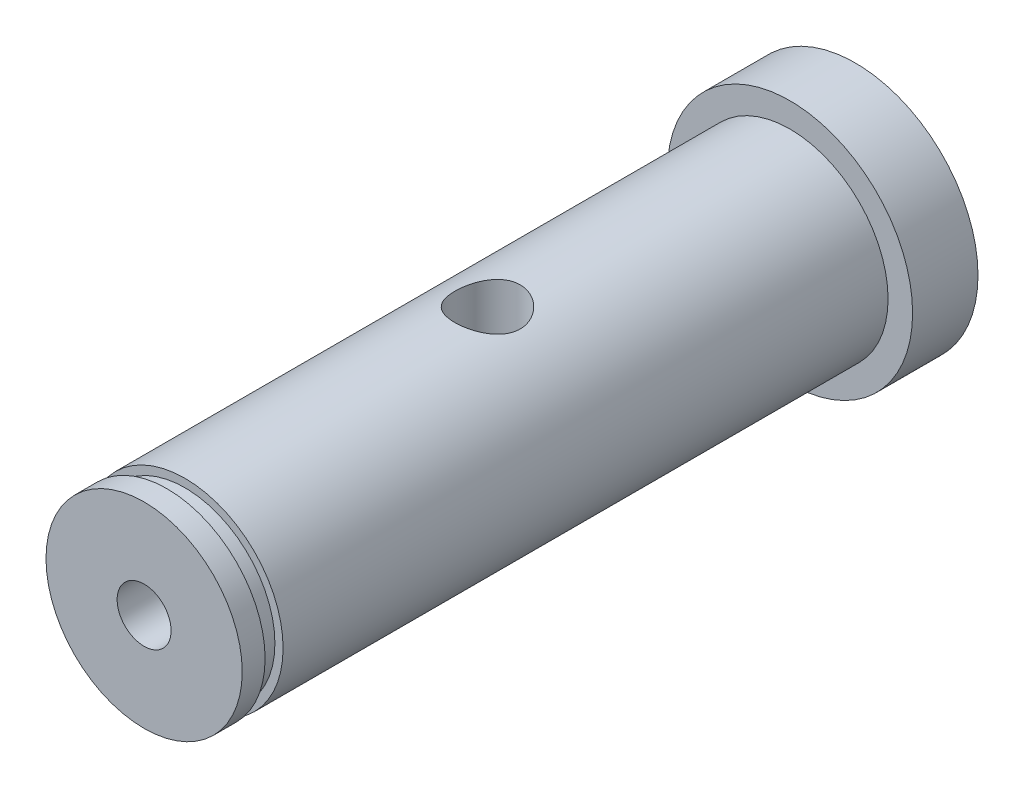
SolidWorks part; units mm, degrees
ref_plane "前视基准面" through (0, 0, 0) normal (0, 0, 1) x (1, 0, 0)
ref_plane "上视基准面" through (0, 0, 0) normal (0, 1, 0) x (1, 0, 0)
ref_plane "右视基准面" through (0, 0, 0) normal (1, 0, 0) x (0, 0, -1)
sketch "草图1" plane through (0, 0, 0) normal (0, 0, 1) x (1, 0, 0)
  circle A0 centre (0, 0) radius 6
  dimension "D1" = 12
extrude "凸台-拉伸1" add sketch "草图1" along normal mid plane 42
ref_plane "基准面1" through (0, 0, 18.5) normal (0, 0, 1) x (1, 0, 0)
sketch "草图2" plane through (0, 0, 18.5) normal (0, 0, 1) x (1, 0, 0)
  circle A0 centre (0, 0) radius 5.5
  circle A1 centre (0, 0) radius 7.2499
  dimension "D1" = 11
extrude "切除-拉伸1" cut sketch "草图2" along normal blind 1.1
hole_wizard "M4 螺纹孔1" positions "3D草图1" profile "草图4" tap size "M4" standard "GB"
sketch3d "3D草图1"
  line L0 (0, 0, 21) -> (0, 0, 19.6) construction
  point P0 (0, 0, 21)
sketch "草图4" plane through (0, 0, 21) normal (1, 0, 0) x (0, -1, 0)
  line L0 (0, 0) -> (0, 10.0914)
  line L1 (0, 10.0914) -> (1.65, 9.1)
  line L2 (1.65, 9.1) -> (1.65, 0)
  line L5 (1.65, 0) -> (0, 0)
  line L10 (0, 10.0914) -> (-1.65, 9.1) construction
  line L11 (0, -6.35) -> (0, 107.95) construction
  dimension "螺纹孔钻头直径" = 3.3
  dimension "螺纹孔钻头深度" = 9.1
  dimension "导头角度" = 118
ref_plane "基准面2" through (0, 0, -18.5) normal (0, 0, 1) x (1, 0, 0)
sketch "草图5" plane through (0, 0, -18.5) normal (0, 0, 1) x (1, 0, 0)
  circle A0 centre (0, 0) radius 7.5
  dimension "D1" = 15
extrude "凸台-拉伸2" add sketch "草图5" against normal blind 4
sketch "草图6" plane through (0, 0, 0) normal (0, 1, 0) x (1, 0, 0)
  circle A0 centre (0, 0) radius 2
  dimension "D1" = 4
extrude "切除-拉伸2" cut sketch "草图6" against normal mid plane 23
